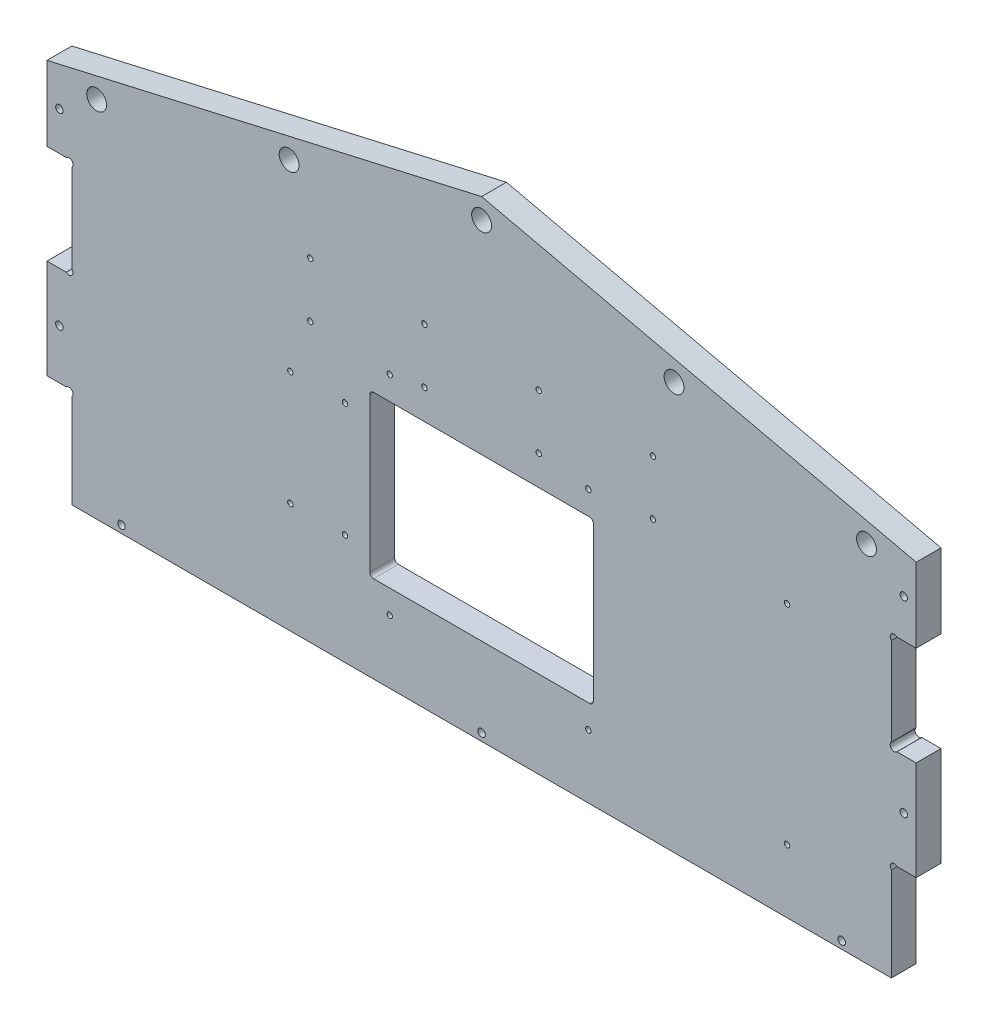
SolidWorks part; units mm, degrees
ref_plane "Plan de face" through (0, 0, 0) normal (0, 0, 1) x (1, 0, 0)
ref_plane "Plan de dessus" through (0, 0, 0) normal (0, 1, 0) x (1, 0, 0)
ref_plane "Plan de droite" through (0, 0, 0) normal (1, 0, 0) x (0, 0, -1)
sketch "Esquisse1" plane through (0, 0, 0) normal (0, 0, 1) x (1, 0, 0)
  line L0 (0, 40) -> (10, 40)
  line L1 (0, -55) -> (0, 55) construction
  line L2 (10, 40) -> (10, 0)
  line L3 (55, 0) -> (-55, 0) construction
  line L4 (10, 0) -> (340, 0)
  line L5 (340, 0) -> (340, 40)
  line L6 (340, 40) -> (350, 40)
  line L7 (350, 40) -> (350, 80)
  line L8 (350, 80) -> (340, 80)
  line L9 (340, 80) -> (340, 120)
  line L10 (340, 120) -> (350, 120)
  line L11 (350, 120) -> (350, 150)
  line L12 (350, 150) -> (175, 190)
  line L13 (175, 190) -> (0, 150)
  line L14 (0, 150) -> (0, 120)
  line L15 (0, 120) -> (10, 120)
  line L16 (10, 120) -> (10, 80)
  line L17 (10, 80) -> (0, 80)
  line L18 (0, 80) -> (0, 40)
  line L19 (175, 0) -> (175, 200) construction
  dimension "D1" = 350
  dimension "D2" = 10
  dimension "D3" = 150
  dimension "D4" = 30
extrude "Extrusion1" add sketch "Esquisse1" along normal blind 10
sketch "Esquisse4" plane through (0, 0, 10) normal (0, 0, 1) x (1, 0, 0)
  line L0 (8.8686, 38.8686) -> (8.8686, 118.8686) construction
  line L1 (340, 40) -> (343.3758, 36.6242) construction
  line L2 (340, 80) -> (349.5219, 89.5219) construction
  line L3 (340, 120) -> (350.1777, 109.8223) construction
  line L4 (10, 120) -> (3.4585, 113.4585) construction
  line L5 (10, 80) -> (-5.8114, 95.8114) construction
  line L6 (10, 40) -> (-0.2623, 29.7377) construction
  line L7 (340, 120) -> (350, 120) construction
  line L8 (10, 40) -> (10, 0) construction
  line L9 (10, 120) -> (10, 80) construction
  line L10 (350, 80) -> (340, 80) construction
  line L11 (340, 40) -> (350, 40) construction
  circle A0 centre (8.8686, 118.8686) radius 1.6
  circle A1 centre (8.8686, 81.1314) radius 1.6
  circle A2 centre (8.8686, 38.8686) radius 1.6
  circle A3 centre (341.1314, 118.8686) radius 1.6
  circle A4 centre (341.1314, 81.1314) radius 1.6
  circle A5 centre (341.1314, 38.8686) radius 1.6
  dimension "D1" = 3.2
  dimension "D2" = 45
  dimension "D3" = 45
  dimension "D4" = 45
  dimension "D5" = 45
  dimension "D6" = 45
extrude "Enlèv. mat.-Extru.1_enfourchement" cut sketch "Esquisse4" against normal through all
sketch "Esquisse5" plane through (0, 0, 10) normal (0, 0, 1) x (1, 0, 0)
  line L0 (10, 3) -> (340, 3) construction
  line L1 (10, 37.7373) -> (10, 0) construction
  line L2 (340, 0) -> (340, 37.7373) construction
  line L3 (10, 0) -> (340, 0) construction
  line L4 (175, 0) -> (175, 190) construction
  line L5 (320, 0) -> (320, 10) construction
  line L6 (30, 0) -> (30, 10) construction
  line L7 (350, 150) -> (175, 190) construction
  line L8 (5, 120) -> (5, 151.1429) construction
  line L9 (0, 120) -> (7.7373, 120) construction
  line L10 (175, 190) -> (0, 150) construction
  line L11 (0, 150) -> (0, 120) construction
  line L12 (345, 120) -> (345, 151.1429) construction
  line L13 (342.2627, 120) -> (350, 120) construction
  line L14 (350, 120) -> (350, 150) construction
  line L15 (5, 120) -> (5, 40) construction
  line L16 (0, 40) -> (7.7373, 40) construction
  line L17 (0, 60) -> (13.1298, 60) construction
  line L18 (0, 80) -> (0, 40) construction
  line L19 (345, 120) -> (345, 40) construction
  line L20 (342.2627, 40) -> (350, 40) construction
  line L21 (350, 60) -> (331.155, 60) construction
  line L22 (350, 40) -> (350, 80) construction
  circle A0 centre (30, 3) radius 1.5
  circle A1 centre (175, 3) radius 1.5
  circle A2 centre (320, 3) radius 1.5
  circle A3 centre (5, 135.5714) radius 1.5
  circle A4 centre (345, 135.5714) radius 1.5
  circle A5 centre (5, 60) radius 1.5
  circle A6 centre (345, 60) radius 1.5
  dimension "D4" = 3
  dimension "D1" = 3
  dimension "D2" = 20
  dimension "D3" = 20
  dimension "D5" = 5
  dimension "D6" = 5
extrude "Enlèv. mat.-Extru.2_fixation sol et murs" cut sketch "Esquisse5" against normal through all
sketch "Esquisse6" plane through (0, 0, 10) normal (0, 0, 1) x (1, 0, 0)
  line L0 (0, 141.7937) -> (175, 181.7937) construction
  line L1 (175, 181.7937) -> (350, 141.7937) construction
  line L2 (350, 150) -> (175, 190) construction
  line L3 (175, 190) -> (0, 150) construction
  line L4 (175, 190) -> (175, 0) construction
  line L5 (350, 120) -> (350, 150) construction
  line L6 (0, 150) -> (0, 120) construction
  line L7 (10, 0) -> (340, 0) construction
  circle A0 centre (175, 181.7937) radius 4
  circle A1 centre (330, 146.3651) radius 4
  circle A2 centre (20, 146.3651) radius 4
  circle A3 centre (252.5013, 164.0791) radius 4
  circle A4 centre (97.4987, 164.0791) radius 4
  dimension "D3" = 8
  dimension "D5" = 20
  dimension "D7" = 79.5
  dimension "D1" = 8
  dimension "D2" = 8
  dimension "D4" = 20
  dimension "D6" = 79.5
extrude "Enlèv. mat.-Extru.3_fixation cables" cut sketch "Esquisse6" against normal through all
sketch "Esquisse7" plane through (0, 0, 10) normal (0, 0, 1) x (1, 0, 0)
  line L0 (175, 0) -> (175, 190) construction
  line L1 (10, 0) -> (340, 0) construction
  line L3 (131.5, 100) -> (218.5, 100)
  line L4 (130, 98.5) -> (130, 36.5)
  line L5 (131.5, 35) -> (218.5, 35)
  line L6 (220, 98.5) -> (220, 36.5)
  arc A0 (131.5, 100) -> (130, 98.5) centre (131.5, 98.5) ccw
  arc A1 (220, 98.5) -> (218.5, 100) centre (218.5, 98.5) ccw
  arc A2 (218.5, 35) -> (220, 36.5) centre (218.5, 36.5) ccw
  arc A3 (130, 36.5) -> (131.5, 35) centre (131.5, 36.5) ccw
  point P10 (130, 100)
  point P13 (220, 100)
  point P18 (130, 35)
  dimension "D4" = 1.5
  dimension "D1" = 65
  dimension "D2" = 90
  dimension "D3" = 35
extrude "Enlèv. mat.-Extru.4_fenetre" cut sketch "Esquisse7" against normal through all
sketch "Esquisse8" plane through (0, 0, 10) normal (0, 0, 1) x (1, 0, 0)
  line L0 (175, 0) -> (175, 190) construction
  line L1 (10, 0) -> (340, 0) construction
  line L2 (175, 190) -> (0, 150) construction
  line L3 (80.0085, 112) -> (247.0196, 112) construction
  line L4 (247.0196, 134) -> (80.0085, 134) construction
  line L5 (218.5, 100) -> (131.5, 100) construction
  line L6 (152, 106.921) -> (152, 144.576) construction
  line L7 (198, 106.921) -> (198, 144.576) construction
  line L8 (106, 134) -> (106, 104.7844) construction
  line L9 (244, 134) -> (244, 106.921) construction
  circle A0 centre (198, 134) radius 1.1
  circle A1 centre (198, 112) radius 1.1
  circle A2 centre (152, 112) radius 1.1
  circle A3 centre (152, 134) radius 1.1
  circle A4 centre (106, 134) radius 1.1
  circle A5 centre (106, 112) radius 1.1
  circle A6 centre (244, 134) radius 1.1
  circle A7 centre (244, 112) radius 1.1
  dimension "D2" = 2.2
  dimension "D4" = 46
  dimension "D5" = 46
  dimension "D6" = 46
  dimension "D1" = 12
  dimension "D3" = 22
extrude "Enlèv. mat.-Extru.5_trame1" cut sketch "Esquisse8" against normal through all
sketch "Esquisse10" plane through (0, 0, 10) normal (0, 0, 1) x (1, 0, 0)
  line L0 (105.104, 109.5) -> (340, 109.5) construction
  line L1 (218.5, 100) -> (131.5, 100) construction
  line L2 (340, 82.2627) -> (340, 117.7373) construction
  line L3 (340, 25.5) -> (105.104, 25.5) construction
  line L4 (340, 0) -> (340, 37.7373) construction
  line L5 (131.5, 35) -> (218.5, 35) construction
  line L6 (138, 116.0381) -> (138, 20.3052) construction
  line L7 (130, 98.5) -> (130, 36.5) construction
  line L8 (218, 116.0381) -> (218, 20.3052) construction
  line L9 (298, 116.0381) -> (298, 20.3052) construction
  circle A0 centre (138, 109.5) radius 1.1
  circle A1 centre (218, 109.5) radius 1.1
  circle A2 centre (298, 109.5) radius 1.1
  circle A3 centre (298, 25.5) radius 1.1
  circle A4 centre (218, 25.5) radius 1.1
  circle A5 centre (138, 25.5) radius 1.1
  dimension "D6" = 2.2
  dimension "D1" = 9.5
  dimension "D2" = 9.5
  dimension "D3" = 8
  dimension "D4" = 80
  dimension "D5" = 80
extrude "Enlèv. mat.-Extru.6_fixation glissiere" cut sketch "Esquisse10" against normal through all
sketch "Esquisse11" plane through (0, 0, 0) normal (0, 0, -1) x (-1, 0, 0)
  line L0 (-134.6526, 90.5) -> (-82.7843, 90.5) construction
  line L2 (-134.6526, 44.5) -> (-82.7843, 44.5) construction
  line L4 (-120, 19.61) -> (-120, 112.5408) construction
  line L5 (-98, 19.61) -> (-98, 112.5408) construction
  line L6 (-130, 67.5) -> (-71.3732, 67.5) construction
  line L7 (-130, 98.5) -> (-130, 36.5) construction
  circle A0 centre (-120, 90.5) radius 1.1
  circle A1 centre (-98, 90.5) radius 1.1
  circle A2 centre (-98, 44.5) radius 1.1
  circle A3 centre (-120, 44.5) radius 1.1
  dimension "D5" = 2.2
  dimension "D1" = 22
  dimension "D2" = 46
  dimension "D3" = 23
  dimension "D4" = 10
extrude "Enlèv. mat.-Extru.1" cut sketch "Esquisse11" against normal through all
